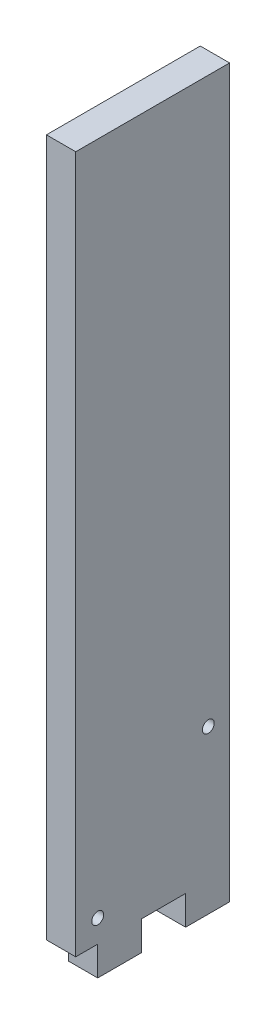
SolidWorks part; units mm, degrees
ref_plane "Front Plane" through (0, 0, 0) normal (0, 0, 1) x (1, 0, 0)
ref_plane "Top Plane" through (0, 0, 0) normal (0, 1, 0) x (1, 0, 0)
ref_plane "Right Plane" through (0, 0, 0) normal (1, 0, 0) x (0, 0, -1)
sketch "Sketch1" plane through (0, 0, 0) normal (1, 0, 0) x (0, 0, -1)
  line L0 (0, 0) -> (15, 0)
  line L1 (15, 0) -> (15, -20)
  line L2 (45, -20) -> (45, 0)
  line L3 (45, 0) -> (75, 0)
  line L4 (90.4963, 90.9175) -> (90.4963, 15.4212) construction
  line L5 (15, 15.4212) -> (90.4963, 15.4212) construction
  line L6 (105, 0) -> (105, 475.9175)
  line L7 (0, 0) -> (0, 475.9175)
  line L8 (54.2636, 475.9175) -> (54.2636, 0) construction
  line L9 (35.2636, 475.9175) -> (35.2636, 0) construction
  line L10 (0, 475.9175) -> (105, 475.9175)
  line L11 (75, 0) -> (75, -20)
  line L12 (75, -20) -> (105, -20)
  line L13 (105, -20) -> (105, 0)
  line L14 (15, -20) -> (45, -20)
  circle A0 centre (15, 15.4212) radius 4.05
  circle A1 centre (90.4963, 90.9175) radius 4.05
  dimension "D1" = 8.1
extrude "Boss-Extrude1" add sketch "Sketch1" along normal blind 20
